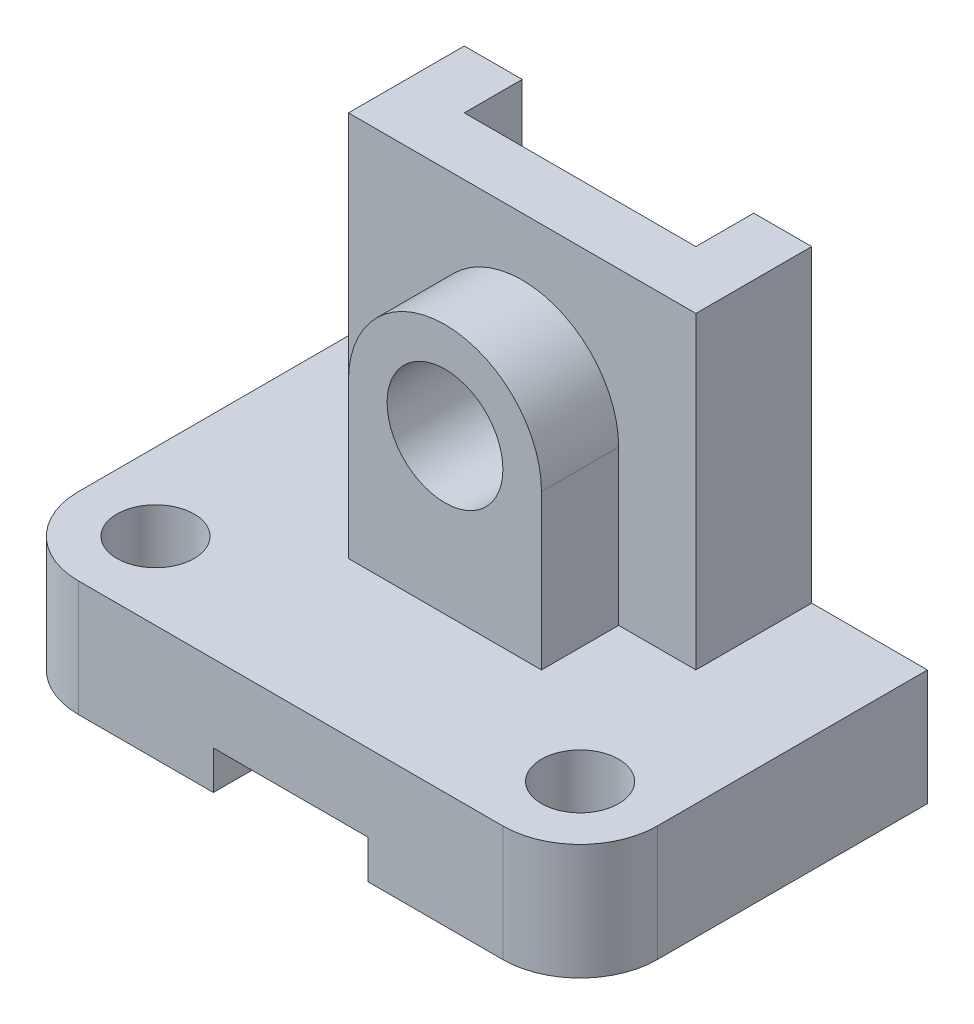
SolidWorks part; units mm, degrees
ref_plane "前视基准面" through (0, 0, 0) normal (0, 0, 1) x (1, 0, 0)
ref_plane "上视基准面" through (0, 0, 0) normal (0, 1, 0) x (1, 0, 0)
ref_plane "右视基准面" through (0, 0, 0) normal (1, 0, 0) x (0, 0, -1)
sketch "草图1" plane through (0, 0, 0) normal (0, 1, 0) x (1, 0, 0)
  line L0 (-15, -7.1198) -> (-6, -7.1198)
  line L1 (-15, -7.1198) -> (-15, -21.1198)
  line L2 (-11, -25.1198) -> (11, -25.1198)
  line L3 (0, 27.7894) -> (0, -75.9791) construction
  line L4 (-6, -7.1198) -> (-6, -10.1198)
  line L5 (-6, -10.1198) -> (6, -10.1198)
  line L6 (6, -7.1198) -> (6, -10.1198)
  line L7 (15, -7.1198) -> (15, -21.1198)
  line L8 (15, -7.1198) -> (6, -7.1198)
  arc A0 (11, -25.1198) -> (15, -21.1198) centre (11, -21.1198) ccw
  arc A1 (-11, -25.1198) -> (-15, -21.1198) centre (-11, -21.1198) cw
  circle A2 centre (-11, -21.1198) radius 2
  circle A3 centre (11, -21.1198) radius 2
  point P12 (0, -25.1198)
  point P13 (0, -10.1198)
  point P15 (15, -25.1198)
  point P18 (-15, -25.1198)
  dimension "D5" = 4
  dimension "D6" = 4
  dimension "D7" = 4
  dimension "D1" = 6
  dimension "D2" = 15
  dimension "D3" = 18
  dimension "D4" = 3
extrude "凸台-拉伸1" add sketch "草图1" against normal blind 6
sketch "草图2" plane through (0, 0, 0) normal (0, 1, 0) x (1, 0, 0)
  line L0 (0, -2.0524) -> (0, -31.9039) construction
  line L1 (6, -10.1198) -> (-6, -10.1198)
  line L2 (6, -10.1198) -> (-6, -10.1198) construction
  line L3 (-6, -10.1198) -> (-6, -7.1198)
  line L4 (-6, -10.1198) -> (-6, -7.1198) construction
  line L5 (-9, -7.1198) -> (-9, -13.1198)
  line L6 (-6, -7.1198) -> (-15, -7.1198) construction
  line L7 (-9, -13.1198) -> (9, -13.1198)
  line L8 (9, -7.1198) -> (9, -13.1198)
  line L9 (6, -10.1198) -> (6, -7.1198)
  line L10 (9, -7.1198) -> (6, -7.1198)
  line L11 (-9, -7.1198) -> (-6, -7.1198)
  point P8 (6, -7.1198)
  point P16 (0, -10.1198)
  point P21 (0, -13.1198)
  dimension "D1" = 6
  dimension "D2" = 3
extrude "凸台-拉伸2" add sketch "草图2" along normal blind 16
sketch "草图4" plane through (0, 0, 13.1198) normal (0, 0, 1) x (1, 0, 0)
  line L0 (0, -2.749) -> (0, 12.2721) construction
  line L1 (-5.166, 8) -> (7.3119, 8) construction
  line L2 (-5, 8) -> (-5, 0)
  line L4 (0, 0) -> (5, 0)
  line L5 (-11, 0) -> (11, 0) construction
  line L6 (5, 0) -> (5, 8)
  line L7 (-5, 0) -> (0, 0)
  arc A1 (5, 8) -> (-5, 8) centre (0, 8) ccw
  dimension "D1" = 5
  dimension "D3" = 8
extrude "凸台-拉伸3" add sketch "草图4" along normal blind 4
sketch "草图5" plane through (0, 0, 0) normal (0, 0, 1) x (1, 0, 0)
  circle A0 centre (0, 8) radius 3
  dimension "D1" = 6
extrude "切除-拉伸1" cut sketch "草图5" along normal blind 24
sketch "草图6" plane through (0, 0, 25.1198) normal (0, 0, 1) x (1, 0, 0)
  line L0 (0, -1.075) -> (0, -7.5524) construction
  line L1 (4, -4) -> (-4, -4)
  line L2 (-4, -4) -> (-4, -6)
  line L3 (-11, -6) -> (11, -6) construction
  line L4 (-4, -6) -> (4, -6)
  line L5 (4, -4) -> (4, -6)
  point P10 (0, -6)
  point P11 (0, -4)
  dimension "D1" = 2
  dimension "D2" = 4
extrude "切除-拉伸2" cut sketch "草图6" against normal blind 24
